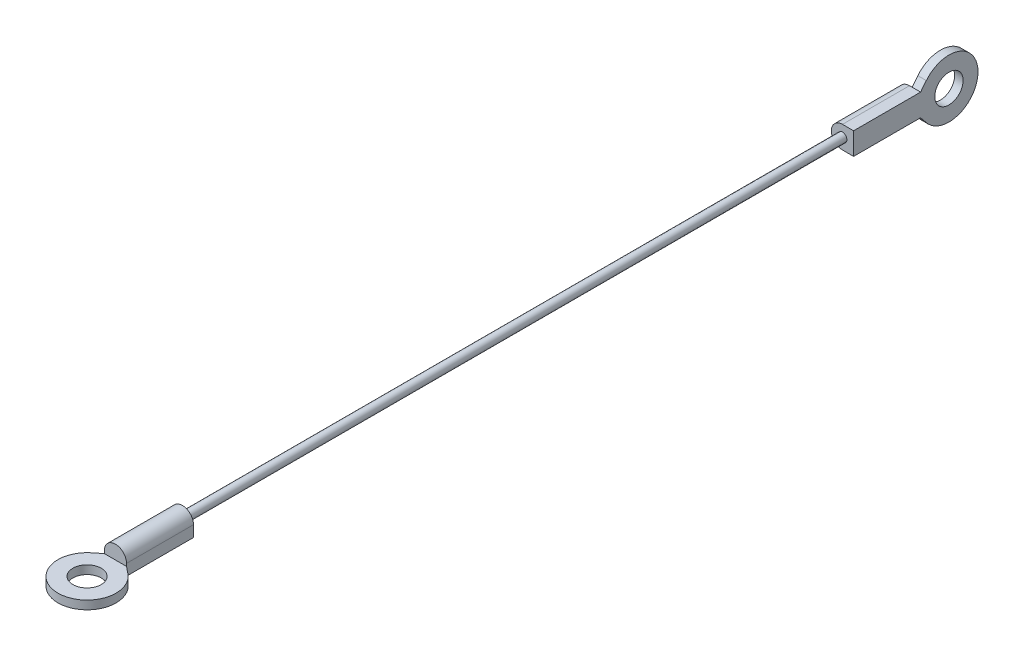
SolidWorks part; units mm, degrees
ref_plane "Front Plane" through (0, 0, 0) normal (0, 0, 1) x (1, 0, 0)
ref_plane "Top Plane" through (0, 0, 0) normal (0, 1, 0) x (1, 0, 0)
ref_plane "Right Plane" through (0, 0, 0) normal (1, 0, 0) x (0, 0, -1)
sketch "Sketch1" plane through (0, 0, 0) normal (0, 0, 1) x (1, 0, 0)
  circle A0 centre (0, 0) radius 0.795
extrude "Boss-Extrude1" add sketch "Sketch1" along normal mid plane 118.24
sketch "Sketch2" plane through (0, 0, 59.12) normal (0, 0, 1) x (1, 0, 0)
  line L0 (-1.99, 0) -> (-1.99, -1.99)
  line L1 (-1.99, -1.99) -> (0, -1.99)
  line L2 (0, -1.99) -> (1.99, -1.99)
  line L3 (1.99, -1.99) -> (1.99, 0)
  arc A0 (1.99, 0) -> (-1.99, 0) centre (0, 0) ccw
  dimension "D1" = 3.98
extrude "Boss-Extrude2" add sketch "Sketch2" along normal blind 12
sketch "Sketch3" plane through (0, -1.99, 0) normal (0, -1, 0) x (1, 0, 0)
  line L0 (1.99, 71.12) -> (3.2639, 72.1455)
  line L1 (-3.2639, 72.1455) -> (-1.99, 71.12)
  line L2 (-1.99, 71.12) -> (1.99, 71.12)
  arc A0 (3.2639, 72.1455) -> (-3.2639, 72.1455) centre (0, 76.2) ccw
  circle A1 centre (0, 76.2) radius 2.54
  point P8 (5.205, 76.2)
  point P9 (-5.205, 76.2)
  dimension "D1" = 5.08
  dimension "D2" = 10.41
  dimension "D3" = 76.2
extrude "Boss-Extrude3" add sketch "Sketch3" against normal blind 1.52
sketch "Sketch4" plane through (0, 0, -59.12) normal (0, 0, -1) x (-1, 0, 0)
  line L0 (0, 1.99) -> (-1.99, 1.99)
  line L1 (-1.99, 1.99) -> (-1.99, 0)
  line L2 (-1.99, 0) -> (-1.99, -1.99)
  line L3 (-1.99, -1.99) -> (0, -1.99)
  arc A0 (0, -1.99) -> (0, 1.99) centre (0, 0) ccw
  dimension "D1" = 3.98
extrude "Boss-Extrude4" add sketch "Sketch4" along normal blind 12
sketch "Sketch5" plane through (1.99, 0, 0) normal (1, 0, 0) x (0, 0, -1)
  line L0 (71.12, -1.99) -> (71.12, 1.99)
  line L1 (71.12, 1.99) -> (72.1455, 3.2639)
  line L2 (72.1455, -3.2639) -> (71.12, -1.99)
  arc A0 (72.1455, 3.2639) -> (72.1455, -3.2639) centre (76.2, 0) cw
  circle A1 centre (76.2, 0) radius 2.54
  point P8 (76.2, 5.205)
  point P9 (76.2, -5.205)
  dimension "D1" = 5.08
  dimension "D2" = 10.41
  dimension "D3" = 76.2
extrude "Boss-Extrude5" add sketch "Sketch5" against normal blind 1.52
